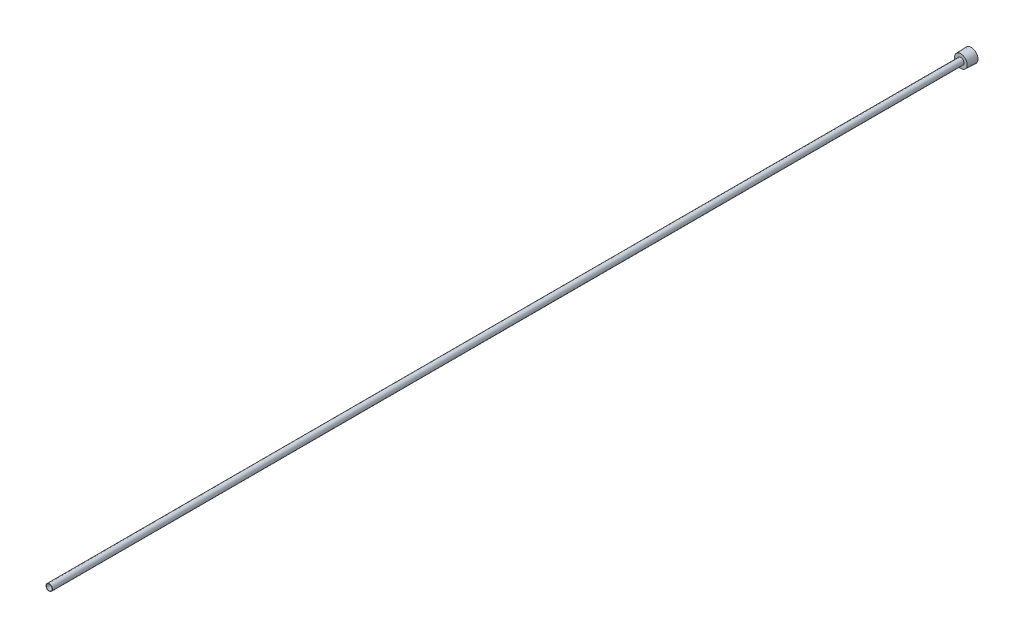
SolidWorks part; units mm, degrees
ref_plane "Front Plane" through (0, 0, 0) normal (0, 0, 1) x (1, 0, 0)
ref_plane "Top Plane" through (0, 0, 0) normal (0, 1, 0) x (1, 0, 0)
ref_plane "Right Plane" through (0, 0, 0) normal (1, 0, 0) x (0, 0, -1)
sketch "Sketch1" plane through (0, 0, 0) normal (1, 0, 0) x (0, 0, -1)
  line L0 (-331.1242, 0) -> (49668.8758, 0) construction
  line L1 (0, 0) -> (-914.4, 0)
  line L6 (0, 0) -> (0, 6.7183)
  line L7 (0, 6.7183) -> (-10.3124, 6.3421)
  line L8 (-10.3124, 3.175) -> (-914.4, 3.175)
  line L9 (-10.3124, 6.3421) -> (-10.3124, 3.175)
  line L10 (-914.4, 3.175) -> (-914.4, 0)
  dimension "D1" = 6.35
  dimension "D2" = 10.3124
  dimension "D3" = 2.089
  dimension "D4" = 13.4366
  dimension "D5" = 914.4
revolve "Revolve1" add sketch "Sketch1" angle 360 about L0
sketch "Sketch2" plane through (0, 0, 914.4) normal (0, 0, 1) x (1, 0, 0)
  circle A0 centre (0, 0) radius 2.921
  dimension "D1" = 5.842
extrude "Cut-Extrude1" cut sketch "Sketch2" against normal through all
sketch "Sketch3" plane through (0, 0, 0) normal (0, 0, -1) x (-1, 0, 0)
  line L0 (0, 7.3901) -> (0, -7.3901) construction
  line L1 (-3.175, -1.8331) -> (0, -3.6662)
  line L2 (0, -3.6662) -> (3.175, -1.8331)
  line L3 (3.175, -1.8331) -> (3.175, 1.8331)
  line L4 (3.175, 1.8331) -> (0, 3.6662)
  line L5 (0, 3.6662) -> (-3.175, 1.8331)
  line L6 (-3.175, 1.8331) -> (-3.175, -1.8331)
  circle A0 centre (0, 0) radius 3.175 construction
  dimension "D1" = 6.35
extrude "Cut-Extrude2" cut sketch "Sketch3" against normal blind 6.35
